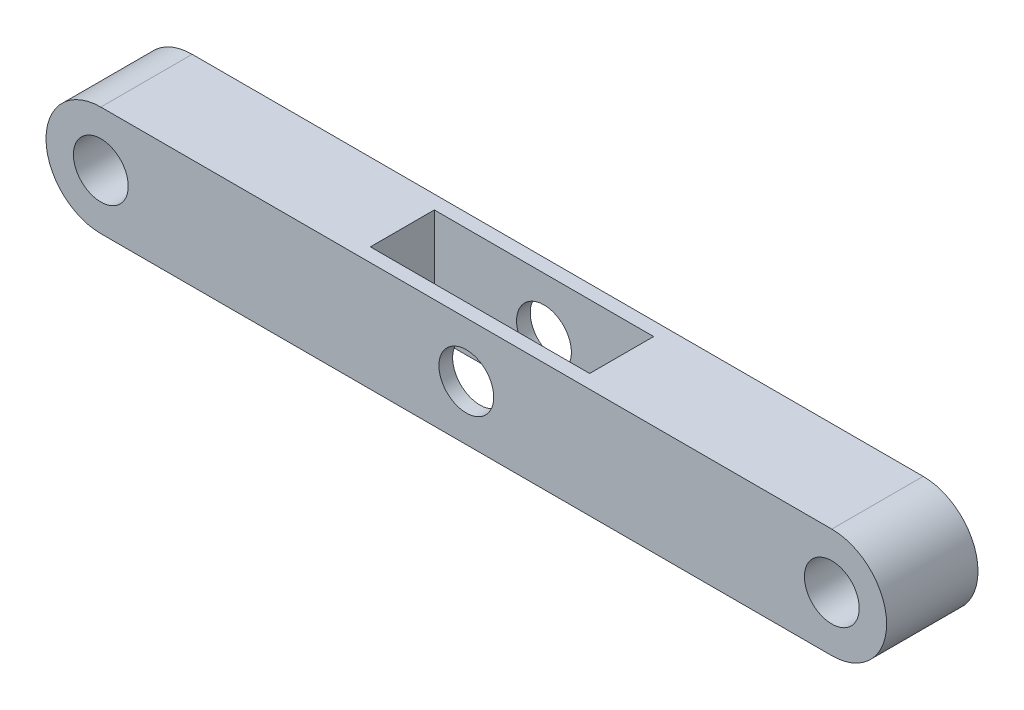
SolidWorks part; units mm, degrees
ref_plane "Front Plane" through (0, 0, 0) normal (0, 0, 1) x (1, 0, 0)
ref_plane "Top Plane" through (0, 0, 0) normal (0, 1, 0) x (1, 0, 0)
ref_plane "Right Plane" through (0, 0, 0) normal (1, 0, 0) x (0, 0, -1)
sketch "Sketch1" plane through (0, 0, 0) normal (0, 0, 1) x (1, 0, 0)
  line L0 (0, 0) -> (80, 0) construction
  line L1 (0, -6) -> (80, -6)
  line L2 (0, 6) -> (80, 6)
  arc A0 (0, -6) -> (0, 6) centre (0, 0) cw
  arc A1 (80, -6) -> (80, 6) centre (80, 0) ccw
  circle A2 centre (0, 0) radius 3
  circle A3 centre (80, 0) radius 3
  dimension "D4" = 6
  dimension "D1" = 80
  dimension "D2" = 6
  dimension "D3" = 6
extrude "Extrude1" add sketch "Sketch1" along normal mid plane 10
sketch "Sketch2" plane through (0, 0, 0) normal (0, 0, 1) x (1, 0, 0)
  line L0 (40, 6) -> (40, -6) construction
  line L1 (80, 6) -> (0, 6) construction
  line L2 (40, 6) -> (52, 6)
  line L3 (52, 6) -> (52, -6)
  line L4 (0, -6) -> (80, -6) construction
  line L5 (28, -6) -> (28, 6)
  line L6 (28, 6) -> (40, 6)
  line L7 (28, -6) -> (52, -6)
  dimension "D2" = 12
extrude "Cut-Extrude1" cut sketch "Sketch2" against normal mid plane 7
sketch "Sketch3" plane through (0, 0, 5) normal (0, 0, 1) x (1, 0, 0)
  line L0 (28, 0) -> (52, 0) construction
  line L1 (28, 6) -> (28, -6) construction
  line L2 (52, -6) -> (52, 6) construction
  circle A0 centre (40, 0) radius 3
  dimension "D1" = 6
extrude "Cut-Extrude2" cut sketch "Sketch3" against normal through all
